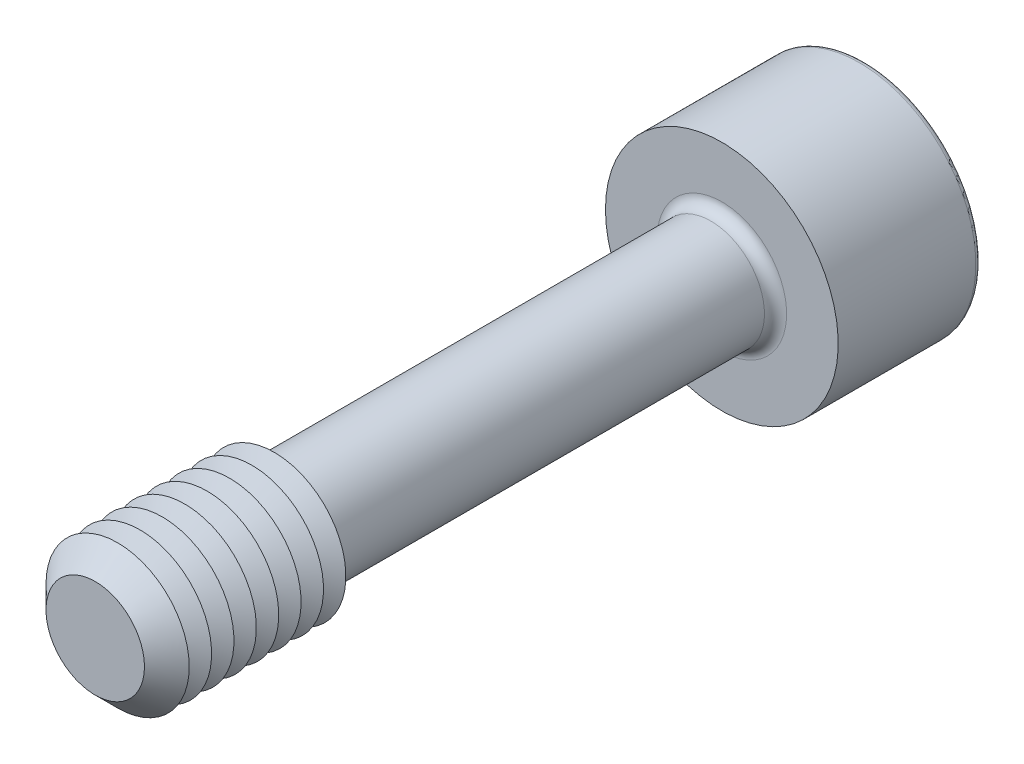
SolidWorks part; units mm, degrees
ref_plane "Front Plane" through (0, 0, 0) normal (0, 0, 1) x (1, 0, 0)
ref_plane "Top Plane" through (0, 0, 0) normal (0, 1, 0) x (1, 0, 0)
ref_plane "Right Plane" through (0, 0, 0) normal (1, 0, 0) x (0, 0, -1)
sketch "Sketch1" plane through (0, 0, 0) normal (0, 0, 1) x (1, 0, 0)
  circle A0 centre (0, 0) radius 3
  dimension "D1" = 6
extrude "Extrude1" add sketch "Sketch1" along normal mid plane 35
sketch "Sketch2" plane through (0, 0, 0) normal (1, 0, 0) x (0, 0, -1)
  line L0 (-17.5, 0) -> (-17.5, 4)
  line L1 (-17.5, 3) -> (-17.5, -3) construction
  line L2 (-17.5, 4) -> (-7.5, 4)
  line L3 (-7.5, 4) -> (-6.9226, 3)
  line L4 (17.5, 3) -> (-17.5, 3) construction
  line L5 (-6.9226, 3) -> (-6.9226, 0)
  line L6 (-6.9226, 0) -> (-17.5, 0)
  dimension "D1" = 4
  dimension "D2" = 120
  dimension "D3" = 10
revolve "Revolve1" add sketch "Sketch2" angle 360 about L6
chamfer "Chamfer1" distance 1.25 angle 45 1 edges at (0, 4, 17.5)
sketch "Sketch3" plane through (0, 0, -17.5) normal (0, 0, -1) x (-1, 0, 0)
  circle A0 centre (0, 0) radius 6.5
  dimension "D1" = 13
extrude "Extrude2" add sketch "Sketch3" along normal blind 8
sketch "Sketch4" plane through (-13.7, 0, -25.5) normal (0, 0, 1) x (1, 0, 0)
  line L2 (11.9679, -3) -> (15.4321, -3)
  line L3 (15.4321, -3) -> (17.1641, 0)
  line L4 (17.1641, 0) -> (15.4321, 3)
  line L6 (15.4321, 3) -> (11.9679, 3)
  line L7 (11.9679, 3) -> (10.2359, 0)
  line L8 (10.2359, 0) -> (11.9679, -3)
  circle A0 centre (13.7, 0) radius 3 construction
  dimension "D1" = 6
extrude "Extrude3" cut sketch "Sketch4" along normal blind 6
fillet "Fillet1" radius 0.62 1 edges at (-3, 0, -17.5)
fillet "Fillet2" radius 0.31 1 edges at (-6.5, 0, -25.5)
sketch "Sketch5" plane through (0, 0, 0) normal (1, 0, 0) x (0, 0, -1)
  line L0 (19.5, 0) -> (19.5, -3)
  line L1 (19.5, -3) -> (17.7679, 0)
  line L2 (17.7679, 0) -> (19.5, 0)
  dimension "D1" = 30
revolve "Cut-Revolve1" cut sketch "Sketch5" angle 360 about L2
sketch "Sketch6" plane through (0, 0, 0) normal (1, 0, 0) x (0, 0, -1)
  line L0 (1.332, 0) -> (-13.289, 0) construction
sketch "Sketch7" plane through (0, 0, 0) normal (1, 0, 0) x (0, 0, -1)
  line L0 (-7.5, 4) -> (-8.125, 2.9175)
  line L1 (-8.125, 2.9175) -> (-8.75, 4)
  line L2 (-7.5, 4) -> (-16.25, 4) construction
  line L3 (-8.75, 4) -> (-7.5, 4)
  dimension "D1" = 1.25
revolve "Cut-Revolve2" cut sketch "Sketch7" angle 360 about L0
pattern_linear "LPattern1" count 7 spacing 1.25 along (0, 0, 1) of "Cut-Revolve2"
